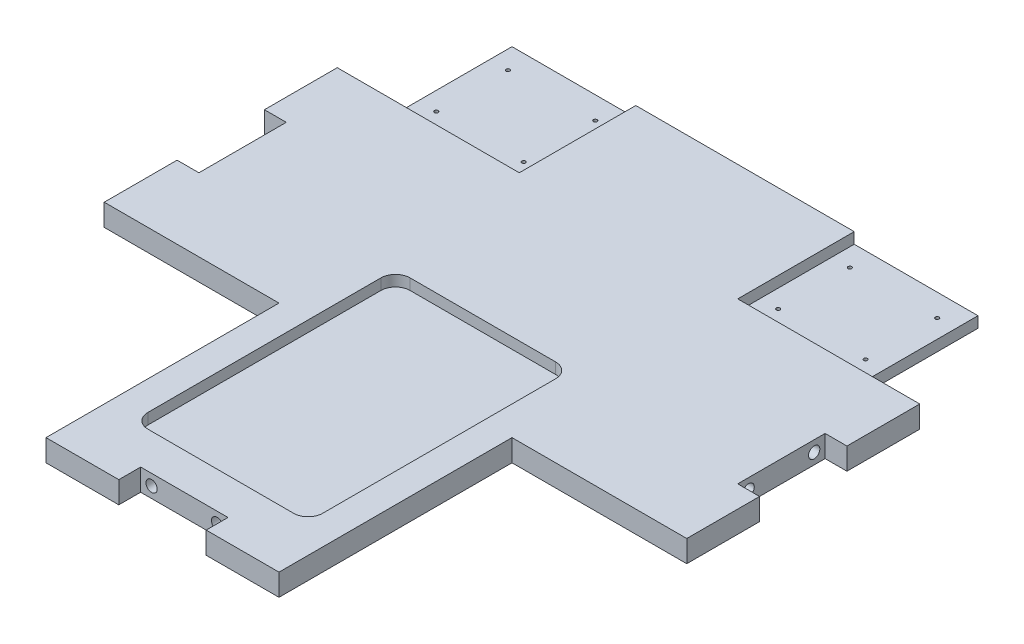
SolidWorks part; units mm, degrees
ref_plane "Front Plane" through (0, 0, 0) normal (0, 0, 1) x (1, 0, 0)
ref_plane "Top Plane" through (0, 0, 0) normal (0, 1, 0) x (1, 0, 0)
ref_plane "Right Plane" through (0, 0, 0) normal (1, 0, 0) x (0, 0, -1)
sketch "Sketch1" plane through (0, 0, 0) normal (0, 1, 0) x (1, 0, 0)
  line L1 (-127, 127) -> (127, 127)
  line L2 (-127, 127) -> (-127, -127)
  line L3 (-127, -127) -> (127, -127)
  line L4 (127, 127) -> (127, -127)
  line L5 (-127, 127) -> (127, -127) construction
  line L6 (-127, -127) -> (127, 127) construction
  point P0 (0, 0)
  dimension "D1" = 254
  dimension "D2" = 254
extrude "Boss-Extrude1" add sketch "Sketch1" along normal blind 9.525
sketch "Sketch2" plane through (0, 9.525, 0) normal (0, 1, 0) x (1, 0, 0)
  line L0 (0, 0) -> (0, 151.7157) construction
  line L1 (-127, 127) -> (-101.6, 127)
  line L2 (-127, 127) -> (-127, 76.2)
  line L3 (-127, 76.2) -> (-101.6, 76.2)
  line L4 (-101.6, 127) -> (-101.6, 76.2)
  line L5 (127, 76.2) -> (101.6, 76.2)
  line L6 (127, 127) -> (127, 76.2)
  line L7 (127, 127) -> (101.6, 127)
  line L8 (101.6, 127) -> (101.6, 76.2)
  dimension "D1" = 50.8
  dimension "D2" = 25.4
extrude "Cut-Extrude1" cut sketch "Sketch2" against normal through all
sketch "Sketch4" plane through (0, 9.525, 0) normal (0, 1, 0) x (1, 0, 0)
  line L0 (0, 127) -> (0, 29.3179) construction
  line L1 (-101.6, 127) -> (-47.625, 127)
  line L2 (-101.6, 127) -> (-101.6, 76.2)
  line L3 (-101.6, 76.2) -> (-47.625, 76.2)
  line L4 (-47.625, 127) -> (-47.625, 76.2)
  line L5 (101.6, 127) -> (-101.6, 127) construction
  line L6 (101.6, 76.2) -> (47.625, 76.2)
  line L7 (101.6, 127) -> (101.6, 76.2)
  line L8 (101.6, 127) -> (47.625, 127)
  line L9 (47.625, 127) -> (47.625, 76.2)
  dimension "D1" = 53.975
  dimension "D2" = 50.8
extrude "Cut-Extrude2" cut sketch "Sketch4" against normal blind 4.7625
sketch "Sketch5" plane through (0, 4.7625, 0) normal (0, 1, 0) x (1, 0, 0)
  line L0 (-101.6, 101.6) -> (101.6, 101.6) construction
  line L1 (-101.6, 127) -> (-101.6, 76.2) construction
  line L2 (101.6, 76.2) -> (101.6, 127) construction
sketch "Sketch6" plane through (0, 9.525, 0) normal (0, 1, 0) x (1, 0, 0)
  line L0 (0, -127) -> (0, 26.9326) construction
  line L1 (-127, -127) -> (-50.8, -127)
  line L2 (-127, -127) -> (-127, -25.4)
  line L3 (-127, -25.4) -> (-50.8, -25.4)
  line L4 (-50.8, -127) -> (-50.8, -25.4)
  line L5 (-127, -127) -> (127, -127) construction
  line L6 (50.8, -127) -> (50.8, -25.4)
  line L7 (127, -25.4) -> (50.8, -25.4)
  line L8 (127, -127) -> (127, -25.4)
  line L9 (127, -127) -> (50.8, -127)
  dimension "D1" = 101.6
  dimension "D2" = 76.2
extrude "Cut-Extrude3" cut sketch "Sketch6" against normal through all
sketch "Sketch7" plane through (0, 9.525, 0) normal (0, 1, 0) x (1, 0, 0)
  line L0 (-127, 76.2) -> (-127, -25.4) construction
  line L1 (-127, 25.4) -> (-41.0029, 25.4) construction
  line L2 (0, 0) -> (0, -32.6591) construction
  line L3 (-127, 44.45) -> (-117.475, 44.45)
  line L4 (-127, 44.45) -> (-127, 6.35)
  line L5 (-127, 6.35) -> (-117.475, 6.35)
  line L6 (-117.475, 44.45) -> (-117.475, 6.35)
  line L7 (117.475, 44.45) -> (117.475, 6.35)
  line L8 (127, 6.35) -> (117.475, 6.35)
  line L9 (127, 44.45) -> (127, 6.35)
  line L10 (127, 44.45) -> (117.475, 44.45)
  line L11 (0, -127) -> (0, -107.95) construction
  line L13 (-19.05, -127) -> (19.05, -127)
  line L14 (-19.05, -127) -> (-19.05, -117.475)
  line L15 (-50.8, -127) -> (50.8, -127) construction
  line L16 (-19.05, -117.475) -> (19.05, -117.475)
  line L17 (19.05, -127) -> (19.05, -117.475)
  point P10 (-117.475, 25.4)
  point P27 (0, -117.475)
  dimension "D1" = 38.1
  dimension "D2" = 9.525
  dimension "D3" = 38.1
  dimension "D4" = 9.525
extrude "Cut-Extrude4" cut sketch "Sketch7" against normal through all
sketch3d "3DSketch1"
  line L0 (-117.475, 4.7625, -44.45) -> (-117.475, 4.7625, -6.35) construction
  line L1 (-117.475, 0, -44.45) -> (-117.475, 9.525, -44.45) construction
  line L2 (-117.475, 0, -6.35) -> (-117.475, 9.525, -6.35) construction
  line L3 (-19.05, 4.7625, 117.475) -> (19.05, 4.7625, 117.475) construction
  line L4 (-19.05, 0, 117.475) -> (-19.05, 9.525, 117.475) construction
  line L5 (19.05, 0, 117.475) -> (19.05, 9.525, 117.475) construction
  line L6 (117.475, 4.7625, -6.35) -> (117.475, 4.7625, -44.45) construction
  line L7 (117.475, 0, -6.35) -> (117.475, 9.525, -6.35) construction
  line L8 (117.475, 0, -44.45) -> (117.475, 9.525, -44.45) construction
  point P6 (-117.475, 4.7625, -39.6875)
  point P7 (-117.475, 4.7625, -11.1125)
  point P14 (-14.2875, 4.7625, 117.475)
  point P15 (14.2875, 4.7625, 117.475)
  point P22 (117.475, 4.7625, -11.1125)
  point P23 (117.475, 4.7625, -39.6875)
  dimension "D1" = 4.7625
  dimension "D2" = 4.7625
  dimension "D3" = 4.7625
  dimension "D4" = 4.7625
  dimension "D5" = 4.7625
  dimension "D6" = 4.7625
hole_wizard "#10 (0.1935) Diameter Hole1" positions "Sketch11" profile "Sketch10" hole size "#10" standard "ANSI Inch"
sketch "Sketch11" plane through (117.475, 0, 0) normal (1, 0, 0) x (0, 0, -1)
  point P0 (11.1125, 4.7625)
  point P3 (39.6875, 4.7625)
sketch "Sketch10" plane through (117.475, 4.7625, -11.1125) normal (0, 1, 0) x (0, 0, -1)
  line L0 (0, 0) -> (0, 14.1766)
  line L1 (0, 14.1766) -> (2.4574, 12.7)
  line L2 (2.4574, 12.7) -> (2.4574, 0)
  line L5 (2.4574, 0) -> (0, 0)
  line L10 (0, 14.1766) -> (-2.4575, 12.7) construction
  line L11 (0, -6.35) -> (0, 107.95) construction
  dimension "Hole Dia." = 4.9149
  dimension "Hole Depth" = 12.7
  dimension "Drill Angle" = 118
hole_wizard "#10 (0.1935) Diameter Hole2" positions "Sketch13" profile "Sketch12" hole size "#10" standard "ANSI Inch"
sketch "Sketch13" plane through (0, 0, 117.475) normal (0, 0, 1) x (1, 0, 0)
  point P0 (-14.2875, 4.7625)
  point P3 (14.2875, 4.7625)
sketch "Sketch12" plane through (-14.2875, 4.7625, 117.475) normal (1, 0, 0) x (0, -1, 0)
  line L0 (0, 0) -> (0, 14.1766)
  line L1 (0, 14.1766) -> (2.4574, 12.7)
  line L2 (2.4574, 12.7) -> (2.4574, 0)
  line L5 (2.4574, 0) -> (0, 0)
  line L10 (0, 14.1766) -> (-2.4575, 12.7) construction
  line L11 (0, -6.35) -> (0, 107.95) construction
  dimension "Hole Dia." = 4.9149
  dimension "Hole Depth" = 12.7
  dimension "Drill Angle" = 118
hole_wizard "#10 (0.1935) Diameter Hole3" positions "Sketch15" profile "Sketch14" hole size "#10" standard "ANSI Inch"
sketch "Sketch15" plane through (-117.475, 0, 0) normal (-1, 0, 0) x (0, 0, 1)
  point P0 (-39.6875, 4.7625)
  point P3 (-11.1125, 4.7625)
sketch "Sketch14" plane through (-117.475, 4.7625, -39.6875) normal (0, 1, 0) x (0, 0, 1)
  line L0 (0, 0) -> (0, 14.1766)
  line L1 (0, 14.1766) -> (2.4574, 12.7)
  line L2 (2.4574, 12.7) -> (2.4574, 0)
  line L5 (2.4574, 0) -> (0, 0)
  line L10 (0, 14.1766) -> (-2.4574, 12.7) construction
  line L11 (0, -6.35) -> (0, 107.95) construction
  dimension "Hole Dia." = 4.9149
  dimension "Hole Depth" = 12.7
  dimension "Drill Angle" = 118
sketch "Sketch16" plane through (0, 4.7625, 0) normal (0, 1, 0) x (1, 0, 0)
  line L0 (0, 0) -> (0, 45.1686) construction
  circle A0 centre (93.599, 117.221) radius 1.651 construction
  circle A1 centre (55.499, 117.221) radius 1.651 construction
  circle A2 centre (55.499, 85.979) radius 1.651 construction
  circle A3 centre (93.599, 85.979) radius 1.651 construction
  circle A4 centre (-55.499, 85.979) radius 1.651 construction
  circle A5 centre (-93.599, 85.979) radius 1.651 construction
  circle A6 centre (-93.599, 117.221) radius 1.651 construction
  circle A7 centre (-55.499, 117.221) radius 1.651 construction
  circle A8 centre (93.599, 117.221) radius 0.7937
  circle A9 centre (55.499, 117.221) radius 0.7937
  circle A10 centre (55.499, 85.979) radius 0.7937
  circle A11 centre (93.599, 85.979) radius 0.7937
  circle A12 centre (-93.599, 85.979) radius 1.651 construction
  circle A13 centre (-55.499, 85.979) radius 1.651 construction
  circle A14 centre (-55.499, 117.221) radius 1.651 construction
  circle A15 centre (-93.599, 117.221) radius 1.651 construction
  circle A16 centre (-93.599, 85.979) radius 0.7938
  circle A17 centre (-55.499, 85.979) radius 0.7938
  circle A18 centre (-55.499, 117.221) radius 0.7938
  circle A19 centre (-93.599, 117.221) radius 0.7938
  dimension "D1" = 1.5875
sketch "Sketch17" plane through (0, 9.525, 0) normal (0, 1, 0) x (1, 0, 0)
  line L0 (0, -117.475) -> (0, 23.0647) construction
  line L1 (19.05, -117.475) -> (-19.05, -117.475) construction
  line L2 (19.05, -127) -> (50.8, -127) construction
  line L3 (-38.1, 12.7) -> (38.1, 12.7)
  line L4 (-38.1, 12.7) -> (-38.1, -101.6)
  line L5 (-38.1, -101.6) -> (38.1, -101.6)
  line L6 (38.1, 12.7) -> (38.1, -101.6)
  line L7 (-38.1, 12.7) -> (38.1, -101.6) construction
  line L8 (-38.1, -101.6) -> (38.1, 12.7) construction
  point P5 (0, -44.45)
  dimension "D1" = 114.3
  dimension "D2" = 76.2
  dimension "D3" = 25.4
extrude "Cut-Extrude6" cut sketch "Sketch17" against normal blind 4.7625
fillet "Fillet1" radius 6.35 4 edges at (-38.1, 7.1438, 101.6) (38.1, 7.1438, 101.6) (38.1, 7.1438, -12.7) (-38.1, 7.1438, -12.7)
extrude "Cut-Extrude7" cut sketch "Sketch16" against normal through all
